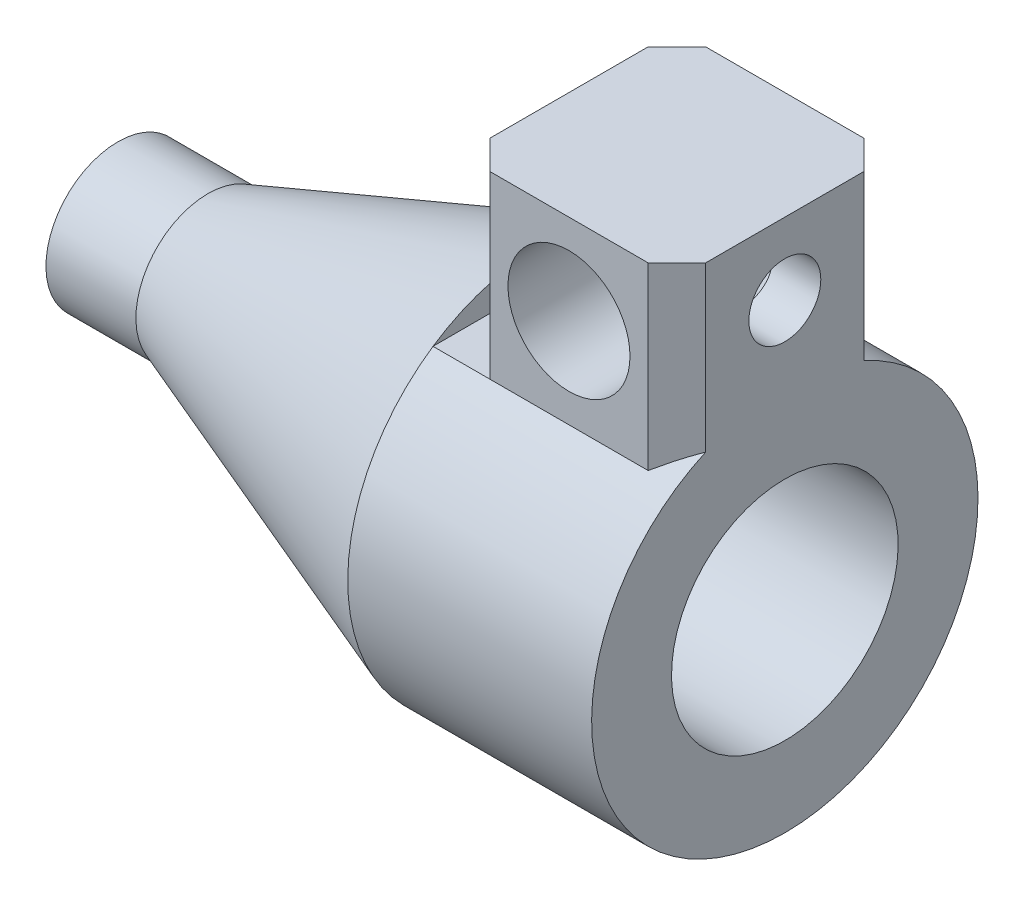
SolidWorks part; units mm, degrees
ref_plane "Front Plane" through (0, 0, 0) normal (0, 0, 1) x (1, 0, 0)
ref_plane "Top Plane" through (0, 0, 0) normal (0, 1, 0) x (1, 0, 0)
ref_plane "Right Plane" through (0, 0, 0) normal (1, 0, 0) x (0, 0, -1)
sketch "Sketch1" plane through (0, 0, 0) normal (0, 0, 1) x (1, 0, 0)
  line L0 (28.047, 34.0995) -> (0, 34.0995)
  line L1 (101.6, 0) -> (0, 0) construction
  line L2 (55, 0) -> (-55, 0) construction
  line L3 (0, 0) -> (0, 34.0995)
  line L4 (0, 29.337) -> (41.275, 29.337)
  line L5 (41.275, 29.337) -> (45.5483, 22.225)
  line L6 (45.5483, 22.225) -> (67.5091, 22.225)
  line L7 (67.5091, 22.225) -> (73.2323, 12.7)
  line L8 (73.2323, 12.7) -> (85.0562, 12.7)
  line L9 (85.0562, 12.7) -> (92.6872, 0)
  line L10 (41.275, 29.337) -> (41.275, 33.2347) construction
  line L11 (67.5091, 22.225) -> (67.5091, 26.1227) construction
  line L12 (85.0562, 12.7) -> (85.0562, 16.5977) construction
  line L13 (0, -55) -> (0, 55) construction
  line L14 (0, 34.0995) -> (-43.0496, 34.0995)
  line L15 (-43.0496, 34.0995) -> (-101.8443, 12.7)
  line L16 (0, 20.0025) -> (-41.91, 20.0025)
  line L17 (-41.91, 20.0025) -> (-46.2978, 12.7)
  line L18 (-46.2978, 12.7) -> (-84.3978, 12.7)
  line L19 (-84.3978, 12.7) -> (-91.1274, 1.5)
  line L20 (-91.1274, 1.5) -> (-117.7193, 1.5)
  line L21 (-101.8443, 12.7) -> (-117.7193, 12.7)
  line L22 (-117.7193, 12.7) -> (-117.7193, 1.5)
  line L23 (-84.3978, 12.7) -> (-84.3978, 19.05) construction
  line L24 (-101.8443, 12.7) -> (-101.8443, 44.7625)
  line L25 (-101.8443, 44.7625) -> (-143.1193, 44.7625)
  line L26 (-143.1193, 44.7625) -> (-143.1193, 0)
  line L27 (-143.1193, 0) -> (-117.7193, 0)
  line L28 (-117.7193, 0) -> (-117.7193, 12.7)
  line L29 (-143.1193, 40) -> (-117.7193, 40)
  line L30 (-117.7193, 40) -> (-117.7193, 12.7)
  arc A0 (99.7302, 4.5) -> (28.047, 34.0995) centre (28.047, -67.5005) ccw
  arc A1 (101.6, 0) -> (99.7302, 4.5) centre (95.25, 0) ccw
  dimension "D1" = 6.35
  dimension "D2" = 95.25
  dimension "D6" = 101.6
  dimension "D3" = 29.337
  dimension "D4" = 4.7625
  dimension "D5" = 41.275
  dimension "D7" = 59
  dimension "D8" = 12.7
  dimension "D9" = 22.225
  dimension "D10" = 20
  dimension "D11" = 41.91
  dimension "D12" = 20.0025
  dimension "D13" = 59
  dimension "D14" = 12.7
  dimension "D15" = 38.1
  dimension "D16" = 1.5
  dimension "D17" = 6.35
  dimension "D18" = 15.875
  dimension "D19" = 12.7
  dimension "D20" = 25.4
  dimension "D21" = 4.7625
  dimension "D22" = 40
revolve "Revolve1" add sketch "Sketch1" angle 360 about L1
sketch "Sketch3" plane through (0, 0, 0) normal (1, 0, 0) x (0, 0, -1)
  line L0 (0, 37.5094) -> (0, -37.5094) construction
  line L1 (-29.1498, 28.282) -> (29.1498, 28.282)
  line L2 (-29.1498, 28.282) -> (-29.1498, 34.0995)
  line L3 (-29.1498, 34.0995) -> (29.1498, 34.0995)
  line L4 (29.1498, 28.282) -> (29.1498, 34.0995)
  line L5 (-29.1498, 28.282) -> (29.1498, 34.0995) construction
  line L6 (-29.1498, 34.0995) -> (29.1498, 28.282) construction
  circle A0 centre (0, 0) radius 34.0995 construction
  arc A1 (19.05, 28.282) -> (-19.05, 28.282) centre (0, 0) ccw
  point P0 (0, 31.1908)
  point P8 (-19.05, 28.282)
  point P9 (19.05, 28.282)
  dimension "D1" = 38.1
extrude "Cut-Extrude1" cut sketch "Sketch3" against normal blind 43.053 contours L1 A1
sketch "Sketch4" plane through (0, 0, 0) normal (1, 0, 0) x (0, 0, -1)
  line L0 (-19.05, 28.282) -> (19.05, 28.282) construction
  line L1 (-19.05, 60.032) -> (19.05, 60.032)
  line L2 (-19.05, 60.032) -> (-19.05, 28.282)
  line L3 (-19.05, 28.282) -> (19.05, 28.282)
  line L4 (19.05, 60.032) -> (19.05, 28.282)
  line L5 (-19.05, 60.032) -> (19.05, 28.282) construction
  line L6 (-19.05, 28.282) -> (19.05, 60.032) construction
  line L7 (0, 37.5094) -> (0, -37.5094) construction
  point P0 (0, 44.157)
  dimension "D1" = 38.1
  dimension "D2" = 31.75
extrude "Boss-Extrude1" add sketch "Sketch4" against normal blind 38.1
hole_wizard "1/4 (0.25) Diameter Hole1" positions "Sketch7" profile "Sketch8" hole size "1/4" standard "Ansi Inch"
sketch "Sketch7" plane through (0, 0, 0) normal (1, 0, 0) x (0, 0, -1)
  line L0 (19.05, 60.032) -> (-19.05, 60.032) construction
  line L1 (0, 37.5094) -> (0, -37.5094) construction
  point P0 (0, 47.332)
  dimension "D1" = 12.7
sketch "Sketch8" plane through (0, 47.332, 0) normal (0, 1, 0) x (0, 0, -1)
  line L0 (0, 0) -> (0, 38.1)
  line L1 (0, 38.1) -> (6.35, 38.1)
  line L2 (6.35, 38.1) -> (6.35, 0)
  line L5 (6.35, 0) -> (0, 0)
  line L11 (0, -6.35) -> (0, 107.95) construction
  dimension "Thru Hole Dia." = 12.7
  dimension "Thru Hole Depth" = 38.1
fillet "Fillet1" [suppressed] radius 12.7
chamfer "Chamfer1" distance 5.08 angle 45 4 edges at (0, 44.157, -19.05) (0, 44.157, 19.05) (-38.1, 44.157, -19.05) (-38.1, 44.157, 19.05)
fillet "Fillet2" [suppressed] radius 5.08
sketch "Sketch9" plane through (0, 0, -19.05) normal (0, 0, -1) x (-1, 0, 0)
  line L0 (19.05, 28.282) -> (19.05, 60.032) construction
  line L1 (33.02, 28.282) -> (5.08, 28.282) construction
  line L2 (33.02, 60.032) -> (5.08, 60.032) construction
  line L3 (5.08, 44.157) -> (33.02, 44.157) construction
  line L4 (5.08, 60.032) -> (5.08, 28.282) construction
  line L5 (33.02, 28.282) -> (33.02, 60.032) construction
  circle A0 centre (19.05, 44.157) radius 10.7696
  dimension "D1" = 21.5392
extrude "Cut-Extrude2" cut sketch "Sketch9" against normal through all
